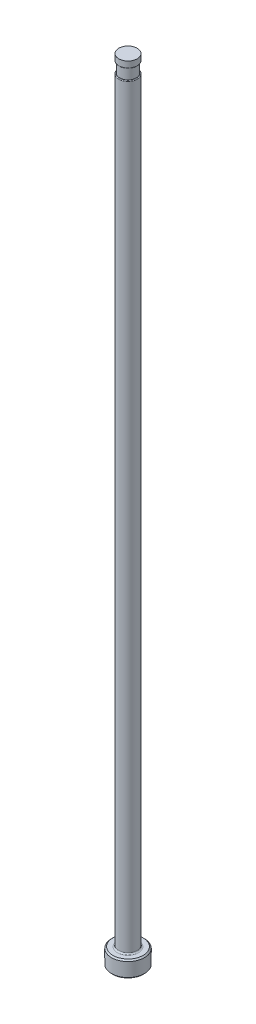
SolidWorks part; units mm, degrees
ref_plane "Front Plane" through (0, 0, 0) normal (0, 0, 1) x (1, 0, 0)
ref_plane "Top Plane" through (0, 0, 0) normal (0, 1, 0) x (1, 0, 0)
ref_plane "Right Plane" through (0, 0, 0) normal (1, 0, 0) x (0, 0, -1)
other "Configuration Table"
sketch "Sketch1" plane through (0, 0, 0) normal (0, 0, 1) x (1, 0, 0)
  line L0 (0, 259.9588) -> (0, -15.1925) construction
  line L1 (0, 0) -> (-3.175, 0)
  line L2 (-3.175, 0) -> (-3.175, 3.175)
  line L3 (-3.175, 3.175) -> (-1.7856, 3.175)
  line L4 (-1.7856, 3.175) -> (-1.7856, 152.4)
  line L5 (-1.7856, 152.4) -> (0, 152.4)
  line L6 (0, 152.4) -> (0, 0)
  dimension "L" = 152.4
  dimension "H" = 6.35
  dimension "T" = 3.175
  dimension "D" = 3.5712
revolve "Revolve1" add sketch "Sketch1" angle 360 about L0
chamfer "Chamfer1" distance 0.254 angle 45 2 edges at (0, 3.175, 3.175) (0, 0, 3.175)
fillet "Fillet1" radius 0.254 1 edges at (0, 3.175, 1.7856)
sketch "Sketch2" plane through (0, 0, 0) normal (0, 0, 1) x (1, 0, 0)
  line L0 (-1.7856, 152.4) -> (-1.7856, 3.429) construction
  line L1 (-1.7856, 151.13) -> (-1.5824, 151.13)
  line L2 (-1.7856, 151.13) -> (-1.7856, 149.098)
  line L3 (-1.7856, 149.098) -> (-1.5824, 149.098)
  line L4 (-1.5824, 151.13) -> (-1.5824, 149.098)
  line L5 (1.7856, 152.4) -> (-1.7856, 152.4) construction
  line L6 (0, 153.4483) -> (0, 147.3282) construction
  dimension "D1" = 2.032
  dimension "N" = 1.27
  dimension "FD" = 0.2032
  dimension "D3" = 3.1648
revolve "Vent Relief" cut sketch "Sketch2" angle 360 about L6
sketch "Sketch3" plane through (0, 0, 0) normal (0, 0, 1) x (1, 0, 0)
  line L0 (-1.5824, 150.114) -> (-1.5824, 86.614)
  line L1 (-1.5824, 151.13) -> (-1.5824, 149.098) construction
  line L2 (-1.7856, 149.098) -> (-1.7856, 3.429) construction
  line L3 (-1.7856, 85.4964) -> (-1.7856, 150.114)
  line L4 (-1.7856, 150.114) -> (-1.5824, 150.114)
  arc A0 (-1.5824, 86.614) -> (-1.7856, 85.4964) centre (-4.7574, 86.614) cw
  dimension "D1" = 3.175
  dimension "D2" = 63.5
extrude "D-Slot" cut sketch "Sketch3" against normal through all both and the other way through all
sketch "Sketch5" plane through (0, 0, 0) normal (0, 0, 1) x (1, 0, 0)
  line L0 (-1.7856, 151.13) -> (1.7856, 151.13) construction
  line L1 (-1.7856, 152.4) -> (-1.7729, 152.4)
  line L2 (-1.7856, 152.4) -> (-1.7856, 151.13)
  line L3 (-1.7856, 151.13) -> (-1.7729, 151.13)
  line L4 (-1.7729, 152.4) -> (-1.7729, 151.13)
  line L5 (0, 152.6877) -> (0, 150.5771) construction
  dimension "VP" = 0.0127
revolve "Vent Diameter" cut sketch "Sketch5" angle 360 about L5
fillet "Fillet2" radius 0.127 2 edges at (1.7856, 149.098, 0) (0, 151.13, 1.7729)
sketch "Pocket Sketch" plane through (0, 0, 0) normal (0, 0, 1) x (1, 0, 0)
  line L0 (-3.5719, 0) -> (-3.5719, 3.2004)
  line L1 (-3.5719, 3.2004) -> (-2.7461, 3.2004)
  line L2 (-1.9841, 3.9624) -> (-1.9841, 22.225)
  line L3 (-1.9841, 22.225) -> (0, 22.225)
  line L4 (0, 22.225) -> (0, 0)
  line L5 (0, 0) -> (-3.5719, 0)
  line L6 (0, 12.6104) -> (0, -2.4989) construction
  line L7 (-3.175, 2.921) -> (-3.175, 0.254) construction
  line L8 (2.921, 3.175) -> (-2.921, 3.175) construction
  line L9 (-1.7856, 85.4964) -> (-1.7856, 3.429) construction
  line L10 (-2.7461, 3.2004) -> (-1.9841, 3.9624)
  point P3 (-1.9841, 3.2004)
  dimension "D1" = 7.1437
  dimension "D2" = 0.3969
  dimension "D3" = 0.0254
  dimension "D4" = 0.1984
  dimension "D5" = 3.9681
  dimension "D6" = 22.225
